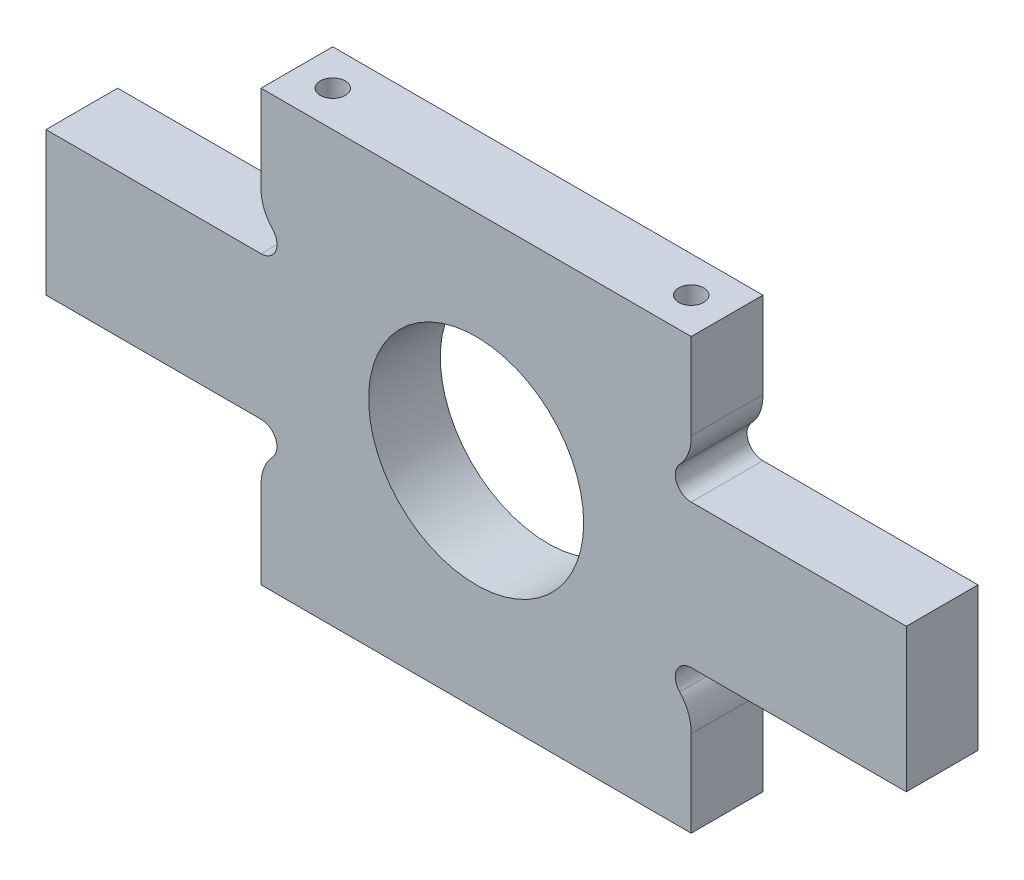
SolidWorks part; units mm, degrees
ref_plane "Plan de face" through (0, 0, 0) normal (0, 0, 1) x (1, 0, 0)
ref_plane "Plan de dessus" through (0, 0, 0) normal (0, 1, 0) x (1, 0, 0)
ref_plane "Plan de droite" through (0, 0, 0) normal (1, 0, 0) x (0, 0, -1)
sketch "Esquisse1" plane through (0, 0, 0) normal (0, 0, 1) x (1, 0, 0)
  line L6 (30, -10) -> (60, -10)
  line L7 (60, -10) -> (60, 10)
  line L8 (60, 10) -> (30, 10)
  line L10 (30, 30) -> (-30, 30)
  line L11 (-30, 30) -> (-30, 18)
  line L12 (-30, 10) -> (-60, 10)
  line L13 (-60, 10) -> (-60, -10)
  line L14 (-60, -10) -> (-30, -10)
  line L15 (-29.9978, -18) -> (-29.9978, -30)
  line L16 (-29.9978, -30) -> (29.9978, -30)
  line L17 (29.9978, -30) -> (29.9978, -18)
  line L18 (0, -55) -> (0, 55) construction
  line L19 (30, 30) -> (30, 18)
  arc A0 (29.9978, -18) -> (28.3796, -13.7374) centre (24, -17.8386) ccw
  arc A1 (30, -10) -> (28.3796, -13.7374) centre (30, -12.22) ccw
  arc A4 (-30, 18) -> (-28.3796, 13.7374) centre (-24.0021, 17.8408) ccw
  arc A5 (-30, 10) -> (-28.3796, 13.7374) centre (-30, 12.22) ccw
  arc A6 (-28.3796, -13.7374) -> (-30, -10) centre (-30, -12.22) ccw
  arc A7 (-28.3796, -13.7374) -> (-29.9978, -18) centre (-24, -17.8386) ccw
  arc A8 (30, 10) -> (28.3796, 13.7374) centre (30, 12.22) cw
  arc A9 (30, 18) -> (28.3796, 13.7374) centre (24.0021, 17.8408) cw
  dimension "D1" = 60
  dimension "D2" = 20
  dimension "D3" = 20
  dimension "D4" = 30
  dimension "D5" = 12
  dimension "D6" = 30
  dimension "D7" = 10
  dimension "D8" = 10
  dimension "D9" = 12
  dimension "D10" = 12
  dimension "D11" = 30
  dimension "D12" = 30
extrude "Boss.-Extru.1" add sketch "Esquisse1" along normal blind 10
sketch "Esquisse3" plane through (0, 0, 10) normal (0, 0, 1) x (1, 0, 0)
  circle A0 centre (0, 0) radius 15
  dimension "D1" = 30
extrude "Enlèv. mat.-Extru.2" cut sketch "Esquisse3" against normal blind 10
ref_plane "sym" through (0, 0, 5) normal (0, 0, 1) x (1, 0, 0)
hole_wizard "Diamètre du perçage Ø3.5 (3.5)1" positions "Esquisse4" profile "Esquisse5" hole size "Ø3.5" standard "ISO"
sketch "Esquisse4" plane through (0, 30, 0) normal (0, 1, 0) x (1, 0, 0)
  line L0 (-33, -5) -> (33, -5) construction
  point P0 (-25, -5)
  point P4 (25, -5)
  dimension "D1" = 25
  dimension "D2" = 25
sketch "Esquisse5" plane through (-25, 30, 5) normal (1, 0, 0) x (0, 0, 1)
  line L0 (0, 0) -> (0, 60)
  line L1 (0, 60) -> (1.75, 60)
  line L2 (1.75, 60) -> (1.75, 0)
  line L5 (1.75, 0) -> (0, 0)
  line L11 (0, -6.35) -> (0, 107.95) construction
  dimension "Diamètre du perçage jusqu'au prochain" = 3.5
  dimension "Profondeur du perçage jusqu'au prochain" = 60
mirror "Symétrie1" about plane through (0, 0, 0) normal (0, 1, 0) of "Diamètre du perçage Ø3.5 (3.5)1"
